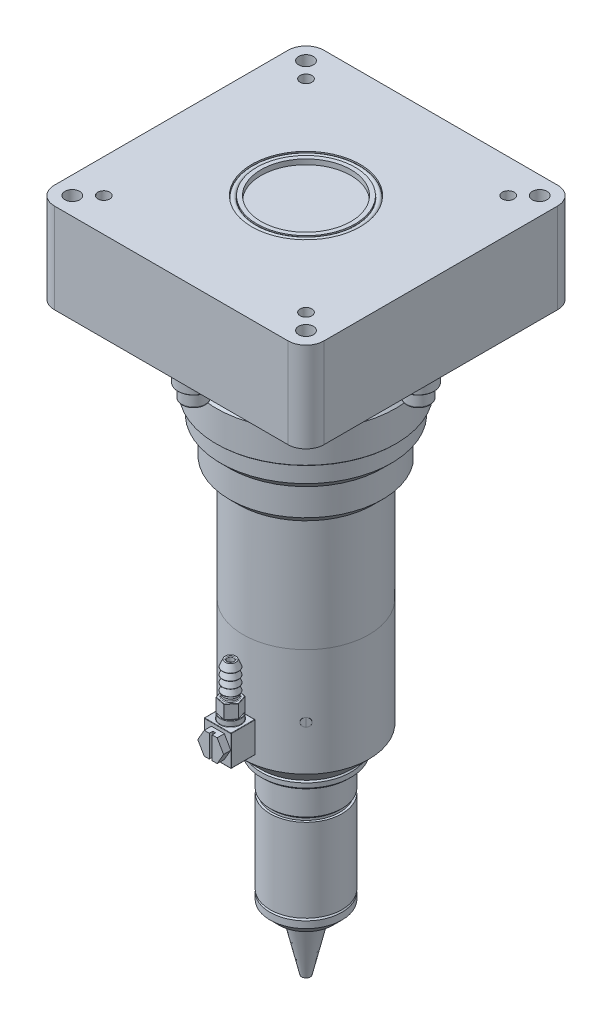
SolidWorks part; units mm, degrees
ref_plane "Front Plane" through (0, 0, 0) normal (0, 0, 1) x (1, 0, 0)
ref_plane "Top Plane" through (0, 0, 0) normal (0, 1, 0) x (1, 0, 0)
ref_plane "Right Plane" through (0, 0, 0) normal (1, 0, 0) x (0, 0, -1)
imported_body "Defeatured1"
hole_wizard "CBORE for M5 SHCS1" positions "Sketch1" profile "Sketch2" counterbore size "M5" standard "HAAS"
sketch "Sketch1" plane through (0, 0, 0) normal (0, -1, 0) x (-1, 0, 0)
  line L0 (0, 0) -> (59.377, 0) construction
  line L2 (0, 0) -> (0, -50.0852) construction
  point P0 (-41.275, 41.275)
  point P12 (41.275, 41.275)
  point P13 (-41.275, -41.275)
  point P14 (41.275, -41.275)
  dimension "D1" = 41.275
  dimension "D2" = 41.275
sketch "Sketch2" plane through (41.275, 0, -41.275) normal (1, 0, 0) x (0, 0, -1)
  line L0 (0, 0) -> (0, 31.75)
  line L1 (0, 31.75) -> (2.6035, 31.75)
  line L3 (2.6035, 31.75) -> (2.6035, 5.334)
  line L4 (2.6035, 5.334) -> (4.3561, 5.334)
  line L5 (4.3561, 5.334) -> (4.3561, 0)
  line L7 (4.3561, 0) -> (0, 0)
  line L11 (0, -6.35) -> (0, 107.95) construction
  dimension "Thru Hole Dia." = 5.207
  dimension "Thru Hole Depth" = 31.75
  dimension "C'Bore Dia." = 8.7122
  dimension "C'Bore Depth" = 5.334
